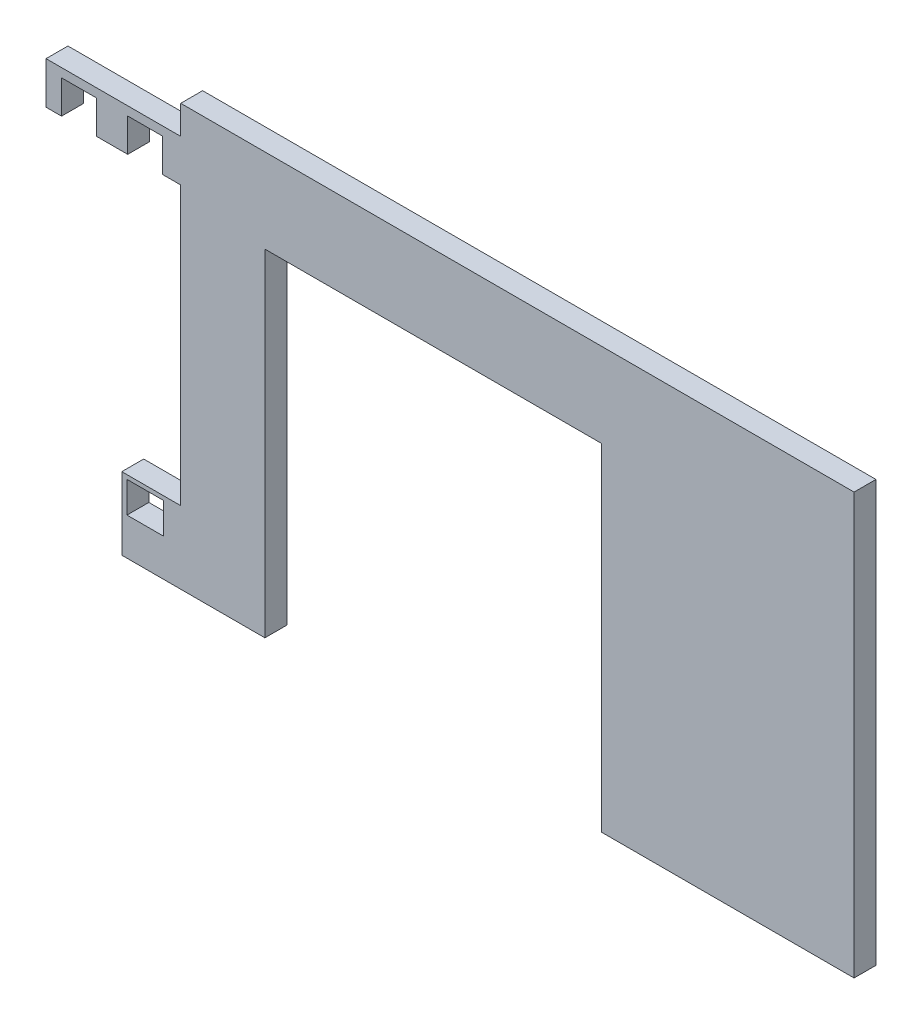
SolidWorks part; units mm, degrees
ref_plane "Front Plane" through (0, 0, 0) normal (0, 0, 1) x (1, 0, 0)
ref_plane "Top Plane" through (0, 0, 0) normal (0, 1, 0) x (1, 0, 0)
ref_plane "Right Plane" through (0, 0, 0) normal (1, 0, 0) x (0, 0, -1)
ref_plane "Front Plane-Chute_Master" through (0, 0, 0) normal (0, 0, 1) x (1, 0, 0)
ref_plane "Top Plane-Chute_Master" through (0, 0, 0) normal (0, 1, 0) x (1, 0, 0)
ref_plane "Right Plane-Chute_Master" through (0, 0, 0) normal (1, 0, 0) x (0, 0, -1)
sketch "Sketch1-Chute_Master" plane through (0, 0, 0) normal (0, 0, 1) x (1, 0, 0)
  line L1 (50.8, -31.75) -> (-50.8, -31.75) construction
  line L2 (50.8, -31.75) -> (50.8, 31.75) construction
  line L3 (50.8, 31.75) -> (-50.8, 31.75) construction
  line L4 (-50.8, -31.75) -> (-50.8, 31.75) construction
  line L5 (50.8, -31.75) -> (-50.8, 31.75) construction
  line L6 (50.8, 31.75) -> (-50.8, -31.75) construction
  point P0 (0, 0)
  dimension "D1" = 63.5
  dimension "D2" = 101.6
sketch "Sketch2-Chute_Master" plane through (0, 0, 0) normal (0, 1, 0) x (1, 0, 0)
  line L1 (-38.1, 0) -> (38.1, 0) construction
  line L2 (-38.1, 0) -> (-38.1, -76.2) construction
  line L3 (-38.1, -76.2) -> (38.1, -76.2) construction
  line L4 (38.1, 0) -> (38.1, -76.2) construction
  dimension "D1" = 76.2
  dimension "D2" = 76.2
sketch "Sketch3-Chute_Master" plane through (0, 0, 0) normal (1, 0, 0) x (0, 0, -1)
  line L1 (0, 0) -> (-76.2, 0) construction
  line L2 (0, 0) -> (0, 45.72) construction
  line L3 (0, 45.72) -> (-76.2, 45.72) construction
  line L4 (-76.2, 0) -> (-76.2, 45.72) construction
  dimension "D1" = 45.72
inserted part "Chute_Master"
sketch "Sketch2" plane through (0, 0, 0) normal (0, 0, 1) x (1, 0, 0)
  line L1 (50.8, -31.75) -> (-50.8, -31.75)
  line L2 (50.8, -31.75) -> (50.8, 31.75)
  line L3 (50.8, 31.75) -> (-50.8, 31.75)
  line L4 (-50.8, -31.75) -> (-50.8, 31.75)
  line L5 (50.8, -31.75) -> (-50.8, 31.75) construction
  line L6 (50.8, 31.75) -> (-50.8, -31.75) construction
  point P0 (0, 0)
extrude "Boss-Extrude1" add sketch "Sketch2" along normal blind 3.302
sketch "Sketch3" plane through (0, 0, 3.302) normal (0, 0, 1) x (1, 0, 0)
  line L0 (50.8, -31.75) -> (-50.8, -31.75) construction
  line L1 (-38.1, -31.75) -> (12.7, -31.75)
  line L2 (-38.1, -31.75) -> (-38.1, 19.05)
  line L3 (-38.1, 19.05) -> (12.7, 19.05)
  line L4 (12.7, -31.75) -> (12.7, 19.05)
  line L5 (-50.8, -31.75) -> (-50.8, 31.75) construction
  dimension "D1" = 50.8
  dimension "D2" = 12.7
  dimension "D3" = 50.8
extrude "Cut-Extrude1" cut sketch "Sketch3" against normal up to next
sketch "Sketch4" plane through (0, 0, 3.302) normal (0, 0, 1) x (1, 0, 0)
  line L0 (-50.8, -31.75) -> (-50.8, 31.75) construction
  line L1 (-50.8, 21.0766) -> (-71.12, 21.0766)
  line L2 (-50.8, 21.0766) -> (-50.8, 27.4266)
  line L3 (-50.8, 27.4266) -> (-71.12, 27.4266)
  line L4 (-71.12, 21.0766) -> (-71.12, 27.4266)
  line L5 (50.8, -31.75) -> (-50.8, -31.75) construction
  line L6 (-50.8, -31.75) -> (-59.69, -31.75)
  line L7 (-50.8, -31.75) -> (-50.8, -20.828)
  line L8 (-50.8, -20.828) -> (-59.69, -20.828)
  line L9 (-59.69, -31.75) -> (-59.69, -20.828)
  line L10 (-69.85, 28.6512) -> (-50.8, 28.6512) construction
  dimension "D1" = 6.35
  dimension "D2" = 10.922
  dimension "D3" = 1.2246
  dimension "D4" = 8.89
extrude "Boss-Extrude3" add sketch "Sketch4" against normal up to surface (3.302 mm away)
sketch "Sketch5" plane through (0, 0, 3.302) normal (0, 0, 1) x (1, 0, 0)
  line L0 (-61.15, -9.565) -> (-61.15, -31.235) construction
  line L1 (-68.7837, 26.093) -> (-63.4989, 26.093)
  line L2 (-68.7837, 26.093) -> (-68.7837, 21.0581)
  line L3 (-68.7837, 21.0581) -> (-63.4989, 21.0581)
  line L4 (-63.4989, 26.093) -> (-63.4989, 21.0581)
  line L5 (-58.8011, 26.093) -> (-58.8011, 21.0581)
  line L6 (-53.5163, 21.0581) -> (-58.8011, 21.0581)
  line L7 (-53.5163, 26.093) -> (-53.5163, 21.0581)
  line L8 (-53.5163, 26.093) -> (-58.8011, 26.093)
  line L10 (-58.9106, -21.4448) -> (-53.3876, -21.4448)
  line L11 (-58.9106, -21.4448) -> (-58.9106, -26.1132)
  line L12 (-58.9106, -26.1132) -> (-53.3876, -26.1132)
  line L13 (-53.3876, -21.4448) -> (-53.3876, -26.1132)
extrude "Cut-Extrude2" cut sketch "Sketch5" against normal up to next
equation "\"thick\"= 0.125in"
